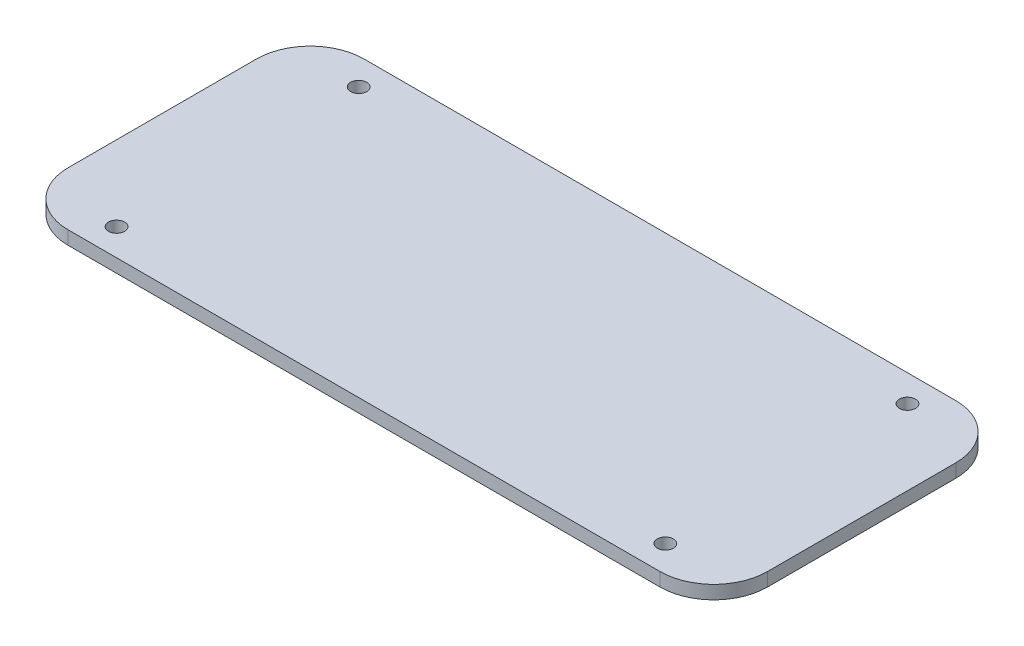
SolidWorks part; units mm, degrees
ref_plane "Front Plane" through (0, 0, 0) normal (0, 0, 1) x (1, 0, 0)
ref_plane "Top Plane" through (0, 0, 0) normal (0, 1, 0) x (1, 0, 0)
ref_plane "Right Plane" through (0, 0, 0) normal (1, 0, 0) x (0, 0, -1)
sketch "Sketch1" plane through (0, 0, 0) normal (0, 1, 0) x (1, 0, 0)
  line L1 (-65, 27.5) -> (65, 27.5)
  line L2 (-65, 27.5) -> (-65, -27.5)
  line L3 (-65, -27.5) -> (65, -27.5)
  line L4 (65, 27.5) -> (65, -27.5)
  line L5 (-65, 27.5) -> (65, -27.5) construction
  line L6 (-65, -27.5) -> (65, 27.5) construction
  point P0 (0, 0)
  dimension "D1" = 130
  dimension "D2" = 55
extrude "Boss-Extrude1" add sketch "Sketch1" along normal blind 2.5
fillet "Fillet1" radius 10 4 edges at (65, 1.25, 27.5) (65, 1.25, -27.5) (-65, 1.25, -27.5) (-65, 1.25, 27.5)
sketch "Sketch2" plane through (0, 0, 0) normal (0, 1, 0) x (1, 0, 0)
  line L0 (55, 27.5) -> (-55, 27.5) construction
  line L1 (-55, -27.5) -> (55, -27.5) construction
  line L2 (-65, 17.5) -> (-65, -17.5) construction
  line L3 (65, -17.5) -> (65, 17.5) construction
  circle A0 centre (-51, 22.5) radius 1.5
  circle A1 centre (-51, -22.5) radius 1.5
  circle A2 centre (51, 22.5) radius 1.5
  circle A3 centre (51, -22.5) radius 1.5
  dimension "D1" = 3
  dimension "D2" = 3
  dimension "D3" = 3
  dimension "D4" = 3
  dimension "D5" = 5
  dimension "D6" = 5
  dimension "D7" = 5
  dimension "D8" = 5
  dimension "D9" = 14
  dimension "D10" = 14
  dimension "D11" = 14
  dimension "D12" = 14
extrude "Cut-Extrude4" cut sketch "Sketch2" against normal blind 4.5 and the other way blind 8
